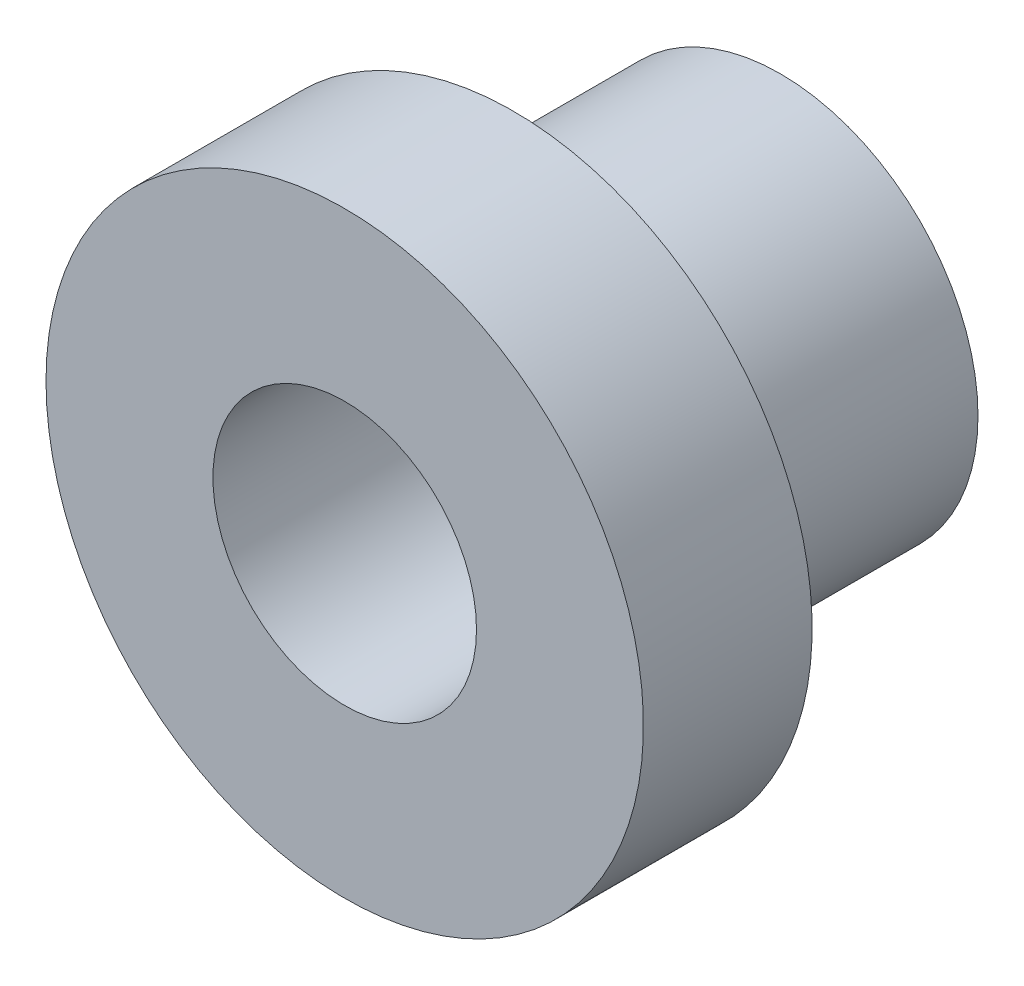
SolidWorks part; units mm, degrees
ref_plane "Front" through (0, 0, 0) normal (0, 0, 1) x (1, 0, 0)
ref_plane "Top" through (0, 0, 0) normal (0, 1, 0) x (1, 0, 0)
ref_plane "Right" through (0, 0, 0) normal (1, 0, 0) x (0, 0, -1)
sketch "Sketch1" plane through (0, 0, 0) normal (0, 0, 1) x (1, 0, 0)
  circle A1 centre (0, 0) radius 10.795
  dimension "D1" = 21.59
extrude "Extrude1" add sketch "Sketch1" along normal blind 6.096
sketch "Sketch2" plane through (0, 0, 0) normal (0, 0, -1) x (-1, 0, 0)
  circle A0 centre (0, 0) radius 7.1374
  dimension "D1" = 14.2748
extrude "Extrude2" add sketch "Sketch2" along normal blind 9.652
sketch "Sketch3" plane through (0, 0, 6.096) normal (0, 0, 1) x (1, 0, 0)
  circle A0 centre (0, 0) radius 4.7625
  dimension "D1" = 9.525
extrude "Cut-Extrude1" cut sketch "Sketch3" against normal through all
